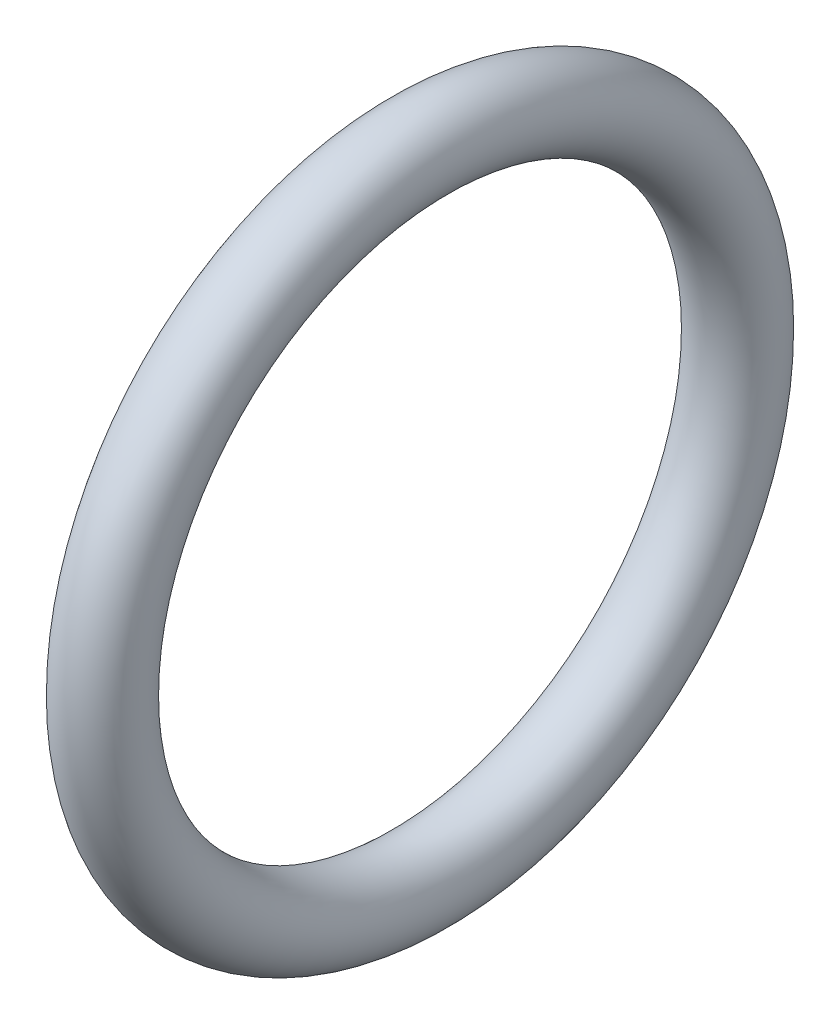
SolidWorks part; units mm, degrees
ref_plane "Front Plane" through (0, 0, 0) normal (0, 0, 1) x (1, 0, 0)
ref_plane "Top Plane" through (0, 0, 0) normal (0, 1, 0) x (1, 0, 0)
ref_plane "Right Plane" through (0, 0, 0) normal (1, 0, 0) x (0, 0, -1)
body saved out of another part "Stock-Keyring-1"
